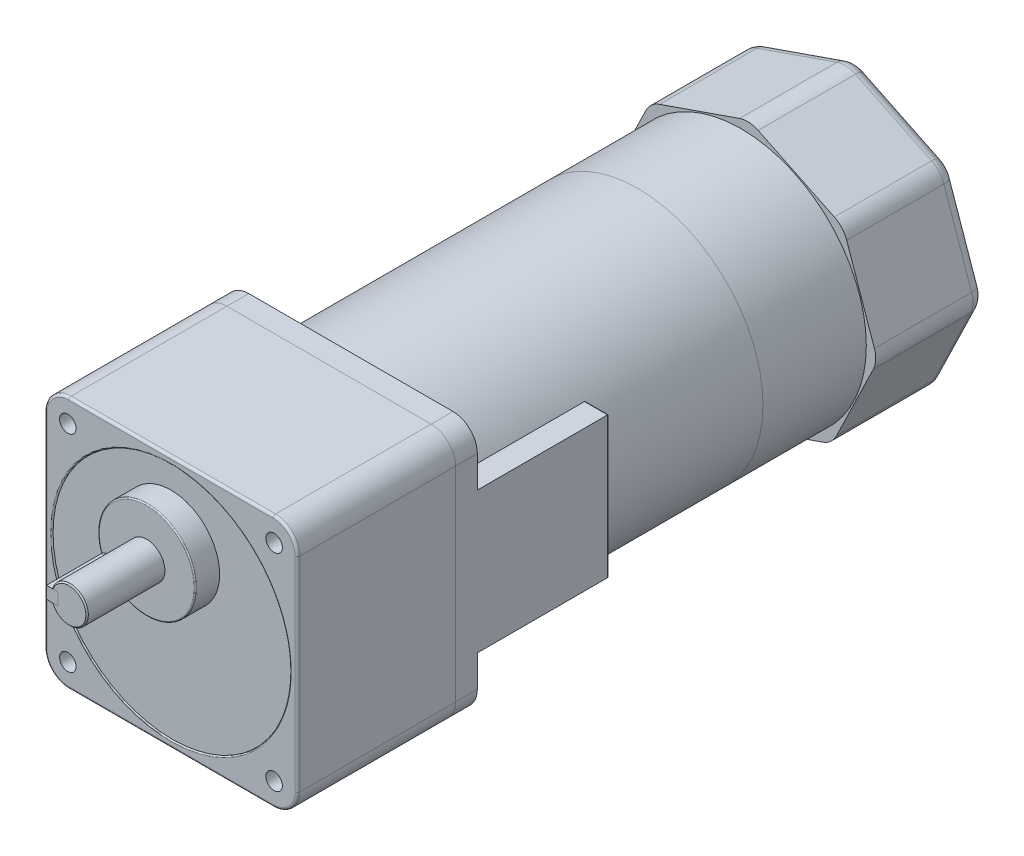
SolidWorks part; units mm, degrees
ref_plane "前视基准面" through (0, 0, 0) normal (0, 0, 1) x (1, 0, 0)
ref_plane "上视基准面" through (0, 0, 0) normal (0, 1, 0) x (1, 0, 0)
ref_plane "右视基准面" through (0, 0, 0) normal (1, 0, 0) x (0, 0, -1)
sketch "草图1" plane through (0, 0, 0) normal (0, 0, 1) x (1, 0, 0)
  line L1 (-42, -52) -> (42, -52)
  line L2 (-52, -42) -> (-52, 42)
  line L3 (-42, 52) -> (42, 52)
  line L4 (52, -42) -> (52, 42)
  line L5 (-52, -52) -> (52, 52) construction
  line L6 (-52, 52) -> (52, -52) construction
  arc A0 (-42, -52) -> (-52, -42) centre (-42, -42) cw
  arc A1 (-52, 42) -> (-42, 52) centre (-42, 42) cw
  arc A2 (42, 52) -> (52, 42) centre (42, 42) cw
  arc A3 (42, -52) -> (52, -42) centre (42, -42) ccw
  point P0 (0, 0)
  dimension "D1" = 10
extrude "凸台-拉伸1" add sketch "草图1" along normal blind 65
sketch "草图2" plane through (0, 0, 0) normal (0, 0, -1) x (-1, 0, 0)
  line L0 (52, 42) -> (52, -42) construction
  line L1 (-42, 52) -> (42, 52)
  line L2 (-52, 42) -> (-52, -42)
  line L3 (-42, -52) -> (42, -52)
  line L4 (52, 42) -> (52, -42)
  line L5 (-52, 52) -> (52, -52) construction
  line L6 (-52, -52) -> (52, 52) construction
  arc A0 (42, -52) -> (52, -42) centre (42, -42) ccw
  arc A1 (-52, -42) -> (-42, -52) centre (-42, -42) ccw
  arc A2 (-42, 52) -> (-52, 42) centre (-42, 42) ccw
  arc A3 (42, 52) -> (52, 42) centre (42, 42) cw
  point P0 (0, 0)
  dimension "D1" = 10
extrude "凸台-拉伸2" add sketch "草图2" along normal blind 9 separate body
sketch "草图3" plane through (0, 0, -9) normal (0, 0, -1) x (-1, 0, 0)
  line L0 (-52, 42) -> (-52, -42) construction
  line L1 (0, 29) -> (-52, 29)
  line L3 (0, -29) -> (-52, -29)
  line L4 (-52, 29) -> (-52, -29)
  line L8 (0, 29) -> (0, -29)
  point P0 (0, 0)
extrude "凸台-拉伸3" add sketch "草图3" along normal blind 54
sketch "草图4" plane through (0, 0, -9) normal (0, 0, -1) x (-1, 0, 0)
  circle A0 centre (0, 0) radius 51.5
extrude "凸台-拉伸4" add sketch "草图4" along normal blind 118 separate body
sketch "草图5" plane through (0, 0, -127) normal (0, 0, -1) x (-1, 0, 0)
  circle A0 centre (0, 0) radius 51.5
extrude "凸台-拉伸5" add sketch "草图5" along normal blind 42.5 separate body
sketch "草图6" plane through (0, 0, -169.5) normal (0, 0, -1) x (-1, 0, 0)
  line L1 (-7.0224, 54.3814) -> (-38.3332, 39.2074)
  line L2 (-43.419, 33.4879) -> (-54.8295, 0.6182)
  line L3 (-54.3814, -7.0224) -> (-39.2074, -38.3332)
  line L4 (-33.4879, -43.419) -> (-0.6182, -54.8295)
  line L5 (7.0224, -54.3814) -> (38.3332, -39.2074)
  line L6 (43.419, -33.4879) -> (54.8295, -0.6182)
  line L7 (54.3814, 7.0224) -> (39.2074, 38.3332)
  line L8 (33.4879, 43.419) -> (0.6182, 54.8295)
  circle A0 centre (0, 0) radius 52 construction
  arc A1 (-54.8295, 0.6182) -> (-54.3814, -7.0224) centre (-45.3825, -2.6612) ccw
  arc A2 (-39.2074, -38.3332) -> (-33.4879, -43.419) centre (-30.2085, -33.9721) ccw
  arc A3 (-0.6182, -54.8295) -> (7.0224, -54.3814) centre (2.6612, -45.3825) ccw
  arc A4 (38.3332, -39.2074) -> (43.419, -33.4879) centre (33.9721, -30.2085) ccw
  arc A5 (54.8295, -0.6182) -> (54.3814, 7.0224) centre (45.3825, 2.6612) ccw
  arc A6 (39.2074, 38.3332) -> (33.4879, 43.419) centre (30.2085, 33.9721) ccw
  arc A7 (-7.0224, 54.3814) -> (0.6182, 54.8295) centre (-2.6612, 45.3825) cw
  arc A8 (-38.3332, 39.2074) -> (-43.419, 33.4879) centre (-33.9721, 30.2085) ccw
  dimension "D1" = 10
extrude "凸台-拉伸6" add sketch "草图6" along normal blind 45 separate body
fillet "圆角1" radius 5 16 edges at (49.1243, 17.0531, -214.5) (41.4449, 36.8535, -214.5) (22.6778, 46.7944, -214.5) (3.2466, 55.3654, -214.5) (-17.0531, 49.1243, -214.5) (-36.8535, 41.4449, -214.5) (-46.7944, 22.6778, -214.5) (-55.3654, 3.2466, -214.5) (-49.1243, -17.0531, -214.5) (-41.4449, -36.8535, -214.5) (-22.6778, -46.7944, -214.5) (-3.2466, -55.3654, -214.5) (17.0531, -49.1243, -214.5) (36.8535, -41.4449, -214.5) (46.7944, -22.6778, -214.5) (55.3654, -3.2466, -214.5)
fillet "圆角2" radius 1 8 edges at (-52, 0, 65) (-49.0711, 49.0711, 65) (0, 52, 65) (49.0711, 49.0711, 65) (52, 0, 65) (49.0711, -49.0711, 65) (0, -52, 65) (-49.0711, -49.0711, 65)
fillet "圆角3" radius 0.5 3 edges at (26, -29, -63) (26, 29, -63) (52, 0, -63)
sketch "草图7" plane through (0, 0, 65) normal (0, 0, 1) x (1, 0, 0)
  point P19 (-42.4264, 42.4264)
  point P20 (-42.4264, -42.4264)
  point P21 (42.4264, -42.4264)
  point P22 (42.4264, 42.4264)
sketch "草图9" plane through (0, 0, -9) normal (0, 0, -1) x (-1, 0, 0)
  circle A5 centre (-42.4264, -42.4264) radius 4.5
  circle A6 centre (42.4264, -42.4264) radius 4.5
  circle A7 centre (-42.4264, 42.4264) radius 4.5
  circle A8 centre (42.4264, 42.4264) radius 4.5
extrude "切除-拉伸1" cut sketch "草图9" against normal blind 51.75
hole_wizard "M8 螺纹孔2" positions "3D草图4" profile "草图11" tap size "M8" standard "GB"
sketch3d "3D草图4"
  point P0 (-42.4264, 42.4264, 65)
  point P3 (42.4264, 42.4264, 65)
  point P6 (42.4264, -42.4264, 65)
  point P9 (-42.4264, -42.4264, 65)
sketch "草图11" plane through (-42.4264, 42.4264, 65) normal (1, 0, 0) x (0, -1, 0)
  line L0 (0, 0) -> (0, 24.2929)
  line L1 (0, 24.2929) -> (3.4, 22.25)
  line L2 (3.4, 22.25) -> (3.4, 0)
  line L5 (3.4, 0) -> (0, 0)
  line L10 (0, 24.2929) -> (-3.4, 22.25) construction
  line L11 (0, -6.35) -> (0, 107.95) construction
  dimension "螺纹孔钻头直径" = 6.8
  dimension "螺纹孔钻头深度" = 22.25
  dimension "导头角度" = 118
sketch "草图12" plane through (0, 0, 65) normal (0, 0, 1) x (1, 0, 0)
  circle A0 centre (0, 20) radius 20
extrude "凸台-拉伸7" add sketch "草图12" along normal blind 10 separate body
fillet "圆角4" radius 0.5 1 edges at (20, 20, 75)
sketch "草图13" plane through (0, 0, 75) normal (0, 0, 1) x (1, 0, 0)
  circle A0 centre (0, 20) radius 7.5
extrude "凸台-拉伸8" add sketch "草图13" along normal blind 32 separate body
ref_plane "基准面1" through (-7.5, 0, 0) normal (1, 0, 0) x (0, 0, -1)
chamfer "倒角2" distance 0.5 angle 45 1 edges at (7.5, 20, 107)
sketch "草图16" plane through (0, 0, 65) normal (0, 0, 1) x (1, 0, 0)
  circle A0 centre (0, 0) radius 49
extrude "切除-拉伸3" cut sketch "草图16" against normal blind 0.5
fillet "圆角5" radius 0.5 1 edges at (49, 0, 65)
sketch "草图19" plane through (-7.5, 0, 0) normal (1, 0, 0) x (0, 0, -1)
  line L1 (-107, 27) -> (-107, 13) construction
  line L2 (-84.5, 22.5) -> (-107, 22.5)
  line L3 (-107, 22.5) -> (-107, 17.5)
  line L4 (-107, 17.5) -> (-84.5, 17.5)
  arc A0 (-84.5, 17.5) -> (-84.5, 22.5) centre (-84.5, 20) ccw
extrude "切除-拉伸4" cut sketch "草图19" along normal blind 3
sketch "草图20" plane through (-4.5, 0, 0) normal (-1, 0, 0) x (0, 0, 1)
  line L0 (84.5, 22.5) -> (107, 22.5)
  line L1 (107, 22.5) -> (107, 17.5)
  line L2 (107, 17.5) -> (84.5, 17.5)
  arc A0 (84.5, 22.5) -> (84.5, 17.5) centre (84.5, 20) ccw
extrude "凸台-拉伸9" add sketch "草图20" along normal blind 5 separate body
chamfer "倒角3" distance 0.3 angle 45 4 edges at (-9.5, 22.5, 95.75) (-9.5, 20, 107) (-9.5, 17.5, 95.75) (-9.5, 20, 82)
